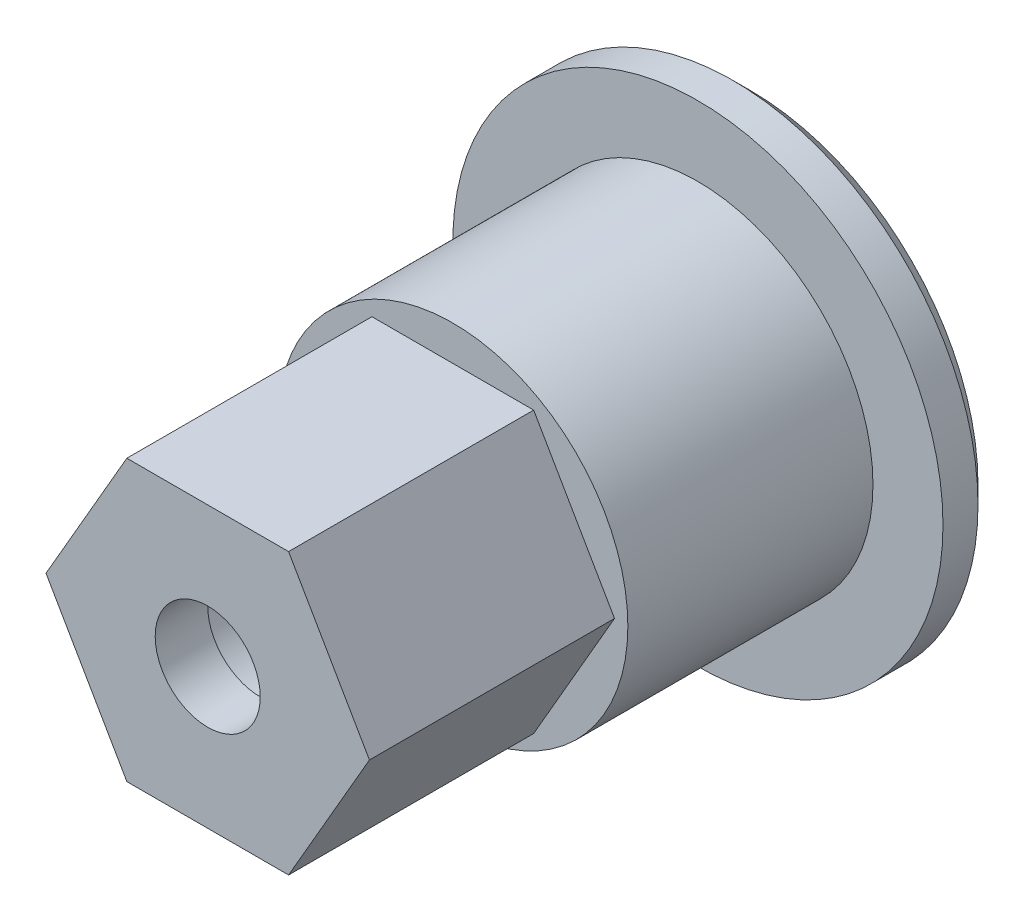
SolidWorks part; units mm, degrees
ref_plane "Plan1" through (0, 0, 0) normal (0, 0, 1) x (1, 0, 0)
ref_plane "Plan2" through (0, 0, 0) normal (0, 1, 0) x (1, 0, 0)
ref_plane "Plan3" through (0, 0, 0) normal (1, 0, 0) x (0, 0, -1)
sketch "Esquisse2" plane through (0, 0, 0) normal (0, 0, 1) x (1, 0, 0)
  circle A0 centre (0, 0) radius 14
  circle A1 centre (0, 0) radius 3
  dimension "D1" = 28
  dimension "D2" = 6
extrude "rondin 28 percé 6" add sketch "Esquisse2" along normal blind 31
sketch "Esquisse3" plane through (0, 0, 31) normal (0, 0, 1) x (1, 0, 0)
  circle A0 centre (0, 0) radius 10
  dimension "D1" = 20
extrude "chariotage 20" cut sketch "Esquisse3" against normal blind 28 flip side to cut
sketch "Esquisse5" plane through (0, 0, 31) normal (0, 0, 1) x (1, 0, 0)
  line L6 (0, 0) -> (0, -11.9956) construction
  line L7 (-4.6188, -8) -> (4.6188, -8)
  line L8 (-9.2376, 0) -> (-4.6188, -8)
  line L9 (-4.6188, 8) -> (-9.2376, 0)
  line L10 (4.6188, 8) -> (-4.6188, 8)
  line L11 (9.2376, 0) -> (4.6188, 8)
  line L12 (4.6188, -8) -> (9.2376, 0)
  dimension "D1" = 8
  dimension "D2" = 16
  dimension "D3" = 16
  dimension "D4" = 8
  dimension "D5" = 120
  dimension "D6" = 120
  dimension "D7" = 8
  dimension "D8" = 120
  dimension "D9" = 8
extrude "hexagone" cut sketch "Esquisse5" against normal blind 14 flip side to cut
sketch "Esquisse6" plane through (0, 0, 0) normal (0, 0, -1) x (-1, 0, 0)
  circle A0 centre (0, 0) radius 4.05
  dimension "D1" = 8.1
extrude "Enlèv. mat.-Extru.4" cut sketch "Esquisse6" against normal blind 28
chamfer "Chanfrein1" distance 1 angle 45
